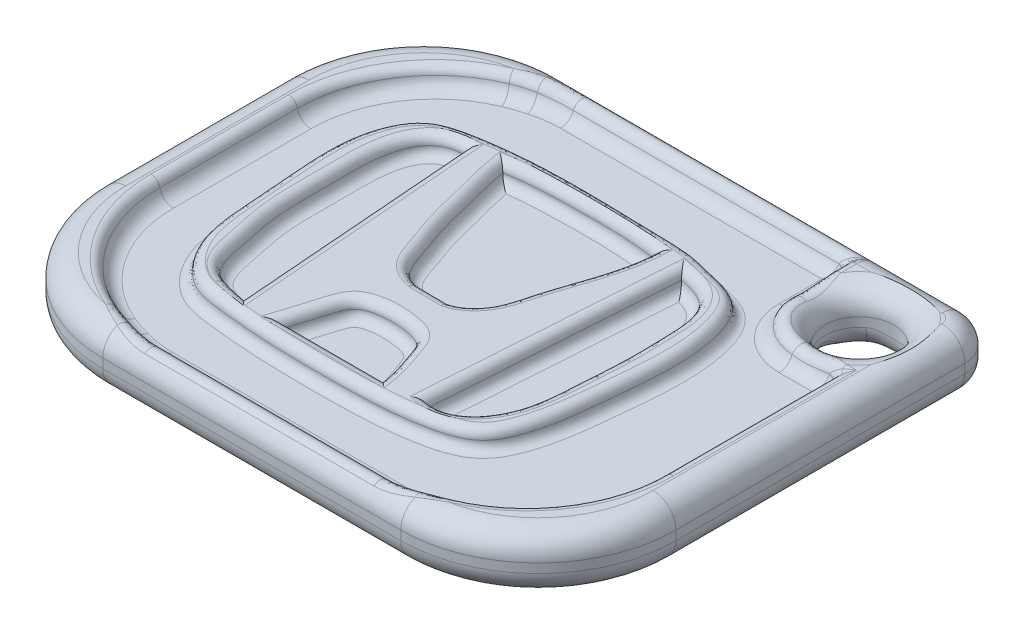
SolidWorks part; units mm, degrees
ref_plane "Ön Düzlem" through (0, 0, 0) normal (0, 0, 1) x (1, 0, 0)
ref_plane "Üst Düzlem" through (0, 0, 0) normal (0, 1, 0) x (1, 0, 0)
ref_plane "Sağ Düzlem" through (0, 0, 0) normal (1, 0, 0) x (0, 0, -1)
sketch "Çizim1" plane through (0, 0, 0) normal (0, 1, 0) x (1, 0, 0)
  line L1 (-41.6667, 37.8333) -> (53.3333, 37.8333)
  line L2 (-71.6667, 7.8333) -> (-71.6667, -32.1667)
  line L3 (-41.6667, -62.1667) -> (23.3333, -62.1667)
  line L4 (53.3333, 37.8333) -> (53.3333, -32.1667)
  arc A0 (23.3333, -62.1667) -> (53.3333, -32.1667) centre (23.3333, -32.1667) ccw
  arc A1 (-71.6667, -32.1667) -> (-41.6667, -62.1667) centre (-41.6667, -32.1667) ccw
  arc A2 (-41.6667, 37.8333) -> (-71.6667, 7.8333) centre (-41.6667, 7.8333) ccw
  circle A3 centre (38.3333, 22.8333) radius 7.5
  point P8 (-71.6667, -62.1667)
  point P11 (-71.6667, 37.8333)
  dimension "D3" = 30
  dimension "D4" = 15
  dimension "D1" = 100
  dimension "D2" = 125
  dimension "D5" = 15
extrude "Yükseklik-Ekstrüzyon1" add sketch "Çizim1" along normal blind 12
sketch "Çizim2" plane through (0, 12, 0) normal (0, 1, 0) x (1, 0, 0)
  line L0 (53.3333, 37.8333) -> (-41.6667, 37.8333) construction
  line L1 (-34.1667, 32.8333) -> (25.8333, 32.8333)
  line L2 (-64.1667, 2.8333) -> (-64.1667, -27.1667)
  line L3 (-34.1667, -57.1667) -> (15.8333, -57.1667)
  line L4 (45.8333, 10.8333) -> (45.8333, -27.1667)
  line L5 (-71.6667, 7.8333) -> (-71.6667, -32.1667) construction
  line L8 (25.8333, 32.8333) -> (25.8333, 20.8333)
  line L9 (35.8333, 10.8333) -> (45.8333, 10.8333)
  arc A0 (15.8333, -57.1667) -> (45.8333, -27.1667) centre (15.8333, -27.1667) ccw
  arc A1 (-64.1667, -27.1667) -> (-34.1667, -57.1667) centre (-34.1667, -27.1667) ccw
  arc A2 (-34.1667, 32.8333) -> (-64.1667, 2.8333) centre (-34.1667, 2.8333) ccw
  arc A3 (25.8333, 20.8333) -> (35.8333, 10.8333) centre (35.8333, 20.8333) ccw
  point P8 (-64.1667, -57.1667)
  point P11 (-64.1667, 32.8333)
  dimension "D3" = 30
  dimension "D8" = 10
  dimension "D1" = 90
  dimension "D2" = 110
  dimension "D4" = 5
  dimension "D5" = 7.5
extrude "Kes-Ekstrüzyon1" cut sketch "Çizim2" against normal blind 4
sketch "Çizim3" plane through (0, 0, 0) normal (0, -1, 0) x (1, 0, 0)
  line L0 (-41.6667, 62.1667) -> (23.3333, 62.1667) construction
  line L1 (-34.1667, 57.1667) -> (15.8333, 57.1667)
  line L2 (-64.1667, 27.1667) -> (-64.1667, -2.8333)
  line L3 (-34.1667, -32.8333) -> (25.8333, -32.8333)
  line L4 (45.8333, 27.1667) -> (45.8333, -10.8333)
  line L6 (-71.6667, -7.8333) -> (-71.6667, 32.1667) construction
  line L11 (25.8333, -32.8333) -> (25.8333, -20.8333)
  line L12 (35.8333, -10.8333) -> (45.8333, -10.8333)
  arc A0 (25.8333, -20.8333) -> (35.8333, -10.8333) centre (35.8333, -20.8333) cw
  arc A1 (-64.1667, -2.8333) -> (-34.1667, -32.8333) centre (-34.1667, -2.8333) ccw
  arc A2 (-34.1667, 57.1667) -> (-64.1667, 27.1667) centre (-34.1667, 27.1667) ccw
  arc A3 (15.8333, 57.1667) -> (45.8333, 27.1667) centre (15.8333, 27.1667) cw
  point P14 (25.8333, -10.8333)
  point P15 (-64.1667, -32.8333)
  point P18 (-64.1667, 57.1667)
  dimension "D7" = 10
  dimension "D1" = 30
  dimension "D2" = 90
  dimension "D3" = 5
  dimension "D4" = 7.5
  dimension "D5" = 22
  dimension "D6" = 20
extrude "Kes-Ekstrüzyon2" cut sketch "Çizim3" against normal blind 4
fillet "Radyus11" radius 5 15 edges at (5.8333, 12, -37.8333) (53.3333, 12, -2.8333) (44.5465, 12, 53.3799) (-9.1667, 12, 62.1667) (-62.8799, 12, 53.3799) (-71.6667, 12, 12.1667) (5.8333, 0, -37.8333) (53.3333, 0, -2.8333) (44.5465, 0, 53.3799) (-9.1667, 0, 62.1667) (-62.8799, 0, 53.3799) (-71.6667, 0, 12.1667) (38.3333, 12, -15.3333) (-62.8799, 12, -29.0465) (-62.8799, 0, -29.0465)
fillet "Radyus12" radius 5 1 edges at (38.3333, 0, -15.3333)
fillet "Radyus13" radius 3 10 edges at (-64.1667, 4, 12.1667) (-55.3799, 4, 48.3799) (-9.1667, 4, 57.1667) (37.0465, 4, 48.3799) (45.8333, 4, 8.1667) (40.8333, 4, -10.8333) (28.7623, 4, -13.7623) (25.8333, 4, -26.8333) (-4.1667, 4, -32.8333) (-55.3799, 4, -24.0465)
fillet "Radyus14" radius 3 2 edges at (25.8333, 0, -27.8333) (38.8331, 0.024, -10.8333)
fillet "Radyus15" radius 3 4 edges at (27.2654, 0.2614, -32.8333) (45.8333, 0.3856, -12.0869) (24.5654, 3.4495, -31.5654) (44.5447, 3.464, -9.5447)
fillet "Radyus18" radius 2 7 edges at (-55.3799, 12, -24.0465) (-64.1667, 12, 12.1667) (-9.1667, 12, 57.1667) (37.0465, 12, 48.3799) (-55.3799, 12, 48.3799) (-4.1667, 12, -32.8333) (45.8333, 12, 8.1667)
fillet "Radyus19" radius 7 3 edges at (51.8689, 1.4645, -36.3689) (51.8689, 10.5355, -36.3689) (53.3333, 6, -37.8333)
fillet "Radyus20" radius 3 10 edges at (40.8333, 8, -10.8333) (25.8333, 8, -26.8333) (-4.1667, 8, -32.8333) (45.8333, 8, 8.1667) (37.0465, 8, 48.3799) (-9.1667, 8, 57.1667) (-55.3799, 8, 48.3799) (-64.1667, 8, 12.1667) (28.7623, 8, -13.7623) (-55.3799, 8, -24.0465)
fillet "Radyus23" radius 2 6 edges at (44.8333, 12, -10.8333) (38.8333, 11.976, -10.8333) (25.8333, 12, -21.8333) (25.8333, 11.6709, -34.6174) (25.8333, 12, -27.8333)
fillet "Radyus24" radius 2 5 edges at (24.5399, 8.5327, -31.8614) (44.8317, 8.6762, -9.7307) (26.2034, 11.1204, -34.163) (46.5684, 11.5492, -11.4674)
sketch "Çizim11" plane through (0, 8, 0) normal (0, 1, 0) x (1, 0, 0)
  line L0 (44.1368, 194.5012) -> (436.8035, 194.5012) construction
  line L1 (-37.3484, 12.6518) -> (-33.2923, -39.7095)
  line L2 (9.7399, 12.6518) -> (6.2095, -39.2842)
  line L3 (-16.6216, -18.3183) -> (-9.9031, -18.3962)
  line L4 (-24.6115, -40.1505) -> (-2.682, -40.1505)
  spline S0 degree 3 poles (-6.2539, 17.7679) (-22.0996, 18.5065) (-37.5769, 16.7221) (-47.5066, 14.5245) (-52.5868, 4.1711) (-52.2596, -7.9795) (-51.023, -21.084) (-50.2863, -33.5736) (-42.9768, -42.3865) (-34.8317, -43.2751) (-26.155, -44.2362) (-14.8164, -44.4835) (-1.8606, -44.4455) (9.2687, -43.3447) (18.6685, -40.6876) (22.9901, -30.7504) (24.0548, -20.7638) (25.3007, -8.2707) (25.5059, 2.7519) (21.5468, 14.2833) (13.7942, 15.7577) (7.4468, 17.5883) (-6.2539, 17.7679) (-22.0996, 18.5065) (-37.5769, 16.7221) knots -0.167283 -0.150041 -0.114464 0 0.044556 0.080802 0.117364 0.174514 0.230106 0.280494 0.326887 0.355214 0.378781 0.435227 0.494939 0.537597 0.57597 0.605567 0.663272 0.701505 0.759296 0.803292 0.832717 0.849959 0.885536 1 1.044556 1.080802 1.117364 only from (-27.6136, 17.7062) to (-27.6136, 17.7062)
  spline S1 degree 3 poles (-38.2455, -38.4941) (-43.3737, -37.0594) (-44.2396, -29.9252) (-46.5143, -20.8675) (-46.7027, -12.9363) (-46.6218, -4.9564) (-46.8012, 5.0251) (-43.5287, 12.8046) (-37.3484, 12.6518) knots 0 0 0 0 0.211382 0.348913 0.483046 0.615893 0.758568 1 1 1 1
  spline S2 degree 2 poles (-38.2455, -38.4941) (-35.8054, -39.2448) (-33.2923, -39.7095) knots 0 0 0 1 1 1
  spline S3 degree 3 poles (9.7399, 12.6518) (11.9592, 12.2465) (16.1374, 11.2282) (19.3303, 5.4661) (19.5817, -1.579) (19.8221, -10.2165) (18.945, -20.5503) (18.5354, -32.7027) (11.6175, -40.364) (6.2095, -39.2842) knots 0 0 0 0 0.110916 0.179961 0.29235 0.437662 0.585762 0.779162 1 1 1 1
  spline S4 degree 3 poles (-9.9031, -18.3962) (-9.4815, -18.2796) (-7.56, -17.5388) (-4.177, -14.3003) (-1.667, -2.8611) (2.5323, 5.8555) (2.9251, 13.6757) knots 0.08485 0.08485 0.08485 0.08485 0.118548 0.243064 0.423031 1 1 1 1
  spline S5 degree 3 poles (-16.6216, -18.3183) (-18.1516, -18.0087) (-21.8343, -16.3094) (-23.3691, -10.51) (-25.9407, -4.2037) (-27.6539, 3.8436) (-29.466, 9.9502) (-30.0162, 13.4308) knots 0.085549 0.085549 0.085549 0.085549 0.201184 0.375278 0.510791 0.730717 1 1 1 1
  spline S6 degree 3 poles (-30.0162, 13.4308) (-25.7669, 14.2283) (-14.7533, 14.6117) (-3.7357, 14.689) (2.9251, 13.6757) knots 0 0 0 0 0.39114 1 1 1 1
  spline S7 degree 3 poles (-24.6115, -40.1505) (-23.6643, -37.2806) (-22.6877, -33.529) (-20.8265, -28.0305) (-16.1959, -26.6714) (-11.7166, -26.741) (-6.4544, -27.8419) (-4.5095, -33.6137) (-3.1405, -37.1573) (-2.682, -40.1505) knots 0 0 0 0 0.223121 0.323552 0.410288 0.564734 0.685532 0.77747 1 1 1 1
extrude "Yükseklik-Ekstrüzyon8" add sketch "Çizim11" along normal blind 4
fillet "Radyus44" radius 2 12 edges at (7.9747, 8, 13.3162) (-35.3203, 8, 13.5288) (-13.6467, 8, 40.1505) (-13.2624, 8, 18.3572)
fillet "Radyus45" radius 2 12 edges at (-13.2624, 12, 18.3572) (7.9747, 12, 13.3162) (-35.3203, 12, 13.5288) (-13.6467, 12, 40.1505)
